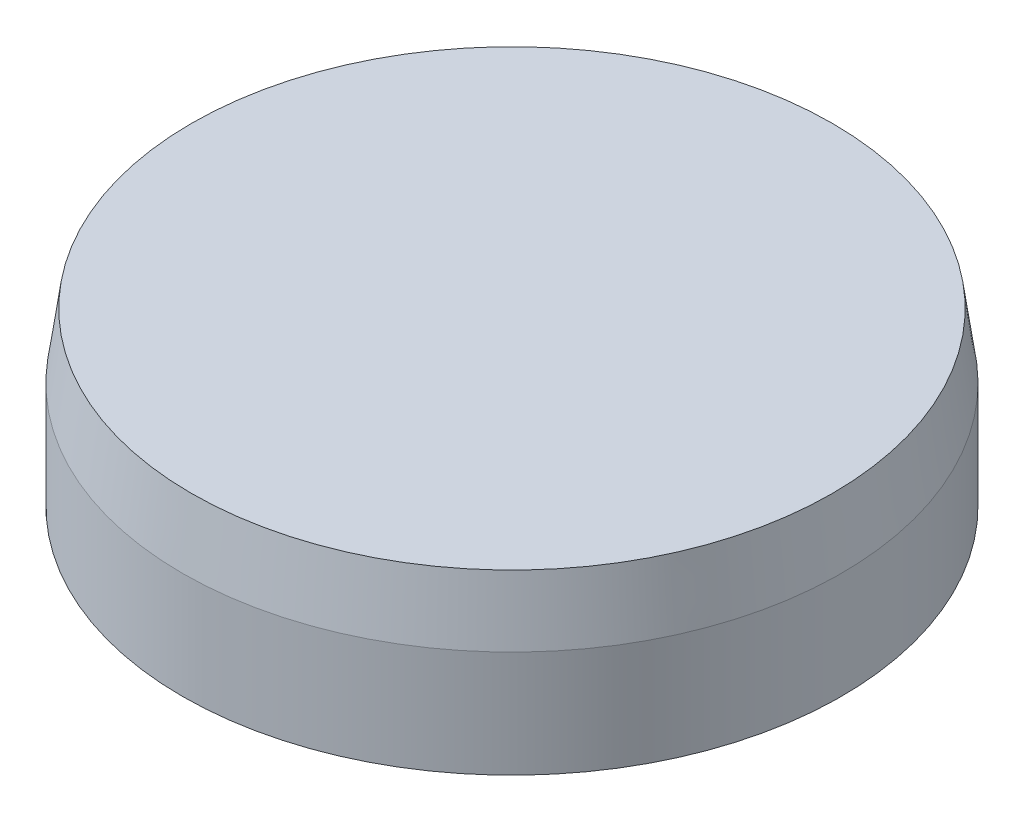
SolidWorks part; units mm, degrees
ref_plane "Front" through (0, 0, 0) normal (0, 0, 1) x (1, 0, 0)
ref_plane "Top" through (0, 0, 0) normal (0, 1, 0) x (1, 0, 0)
ref_plane "Right" through (0, 0, 0) normal (1, 0, 0) x (0, 0, -1)
sketch "Sketch1" plane through (0, 0, 0) normal (0, 1, 0) x (1, 0, 0)
  circle A0 centre (0, 0) radius 12.954
  circle A1 centre (0, 0) radius 10.795
  dimension "D1" = 25.908
  dimension "D2" = 2.159
extrude "Extrude1" add sketch "Sketch1" along normal blind 4.191
sketch "Sketch2" plane through (0, 4.191, 0) normal (0, 1, 0) x (-1, 0, 0)
  circle A0 centre (0, 0) radius 12.954
  circle A1 centre (0, 0) radius 10.795
  circle A2 centre (0, 0) radius 12.954 construction
  circle A3 centre (0, 0) radius 10.795 construction
extrude "Extrude2" add sketch "Sketch2" along normal blind 2.54 draft 8
sketch "Sketch3" plane through (0, 6.731, 0) normal (0, 1, 0) x (-1, 0, 0)
  circle A0 centre (0, 0) radius 12.597
  circle A1 centre (0, 0) radius 12.597 construction
extrude "Extrude3" add sketch "Sketch3" against normal blind 1.27
